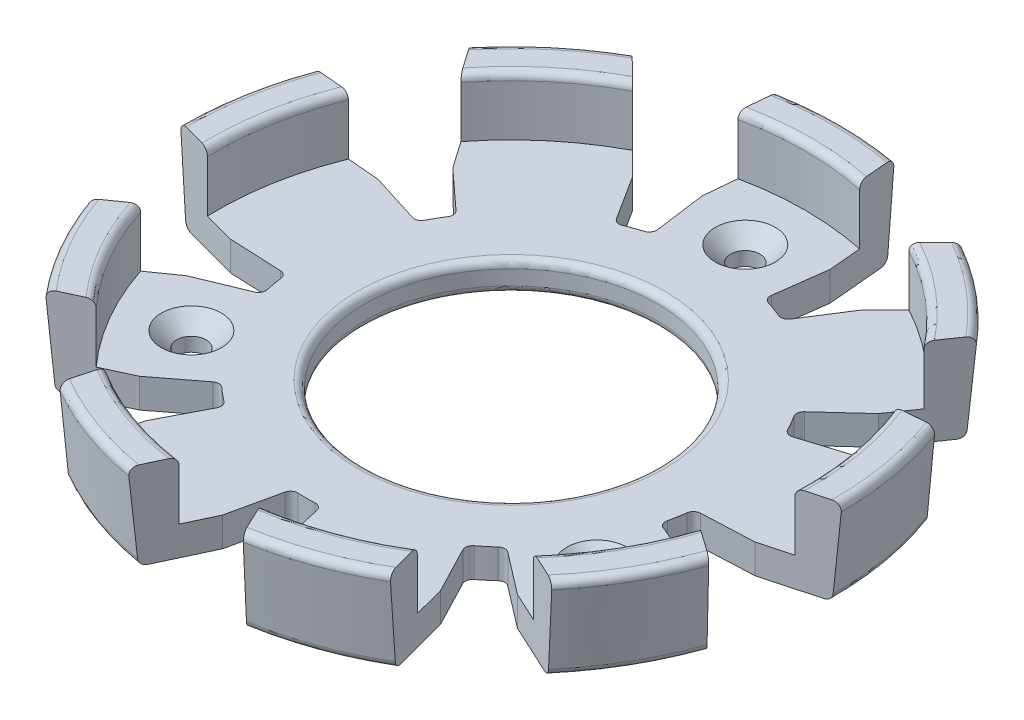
SolidWorks part; units mm, degrees
ref_plane "Plan de face" through (0, 0, 0) normal (0, 0, 1) x (1, 0, 0)
ref_plane "Plan de dessus" through (0, 0, 0) normal (0, 1, 0) x (1, 0, 0)
ref_plane "Plan de droite" through (0, 0, 0) normal (1, 0, 0) x (0, 0, -1)
ref_plane "Plan4" through (0, 2, 0) normal (0, 1, 0) x (-1, 0, 0)
sketch "Esquisse1" plane through (0, 2, 0) normal (0, 1, 0) x (-1, 0, 0)
  line L20 (-3.8364, -13.4641) -> (-4.3585, -17.4299)
  line L21 (-4.3585, -17.4299) -> (-3.9704, -21.7277)
  line L22 (3.9704, -21.7277) -> (4.3585, -17.4299)
  line L23 (4.3585, -17.4299) -> (3.8364, -13.4641)
  line L44 (0, 0) -> (-4.7883, -13.1557)
  line L45 (0, 0) -> (4.7883, -13.1557)
  arc A7 (-4.7883, -13.1557) -> (-3.8364, -13.4641) centre (0, 0) ccw
  arc A8 (-3.9704, -21.7277) -> (3.9704, -21.7277) centre (0, 0) ccw
  arc A9 (3.8364, -13.4641) -> (4.7883, -13.1557) centre (0, 0) ccw
  dimension "D1" = 22.0875
extrude "Extrusion1" add sketch "Esquisse1" against normal blind 2
sketch "Esquisse18" plane through (0, 2, 0) normal (0, 1, 0) x (1, 0, 0)
  line L0 (3.9704, 21.7277) -> (4.1578, 19.6525)
  line L1 (4.3585, 17.4299) -> (3.9704, 21.7277) construction
  line L2 (-3.9704, 21.7277) -> (-4.1578, 19.6525)
  line L3 (-3.9704, 21.7277) -> (-4.3585, 17.4299) construction
  arc A0 (3.9704, 21.7277) -> (-3.9704, 21.7277) centre (0, 0) ccw
  arc A1 (4.1578, 19.6525) -> (-4.1578, 19.6525) centre (0, 0) ccw
  dimension "D1" = 2
extrude "Extrusion13" add sketch "Esquisse18" along normal blind 4
draft "Dépouille1" type of draft neutral plane draft angle 5 faces to draft 1 parameters "D1"=5
fillet "Congé75" radius 0.5 5 edges at (3.8364, 1, -13.4641) (0, 0, -22.0875) (-3.8364, 1, -13.4641) (0, 6, -20.0875) (0, 6, -22.6124)
pattern_circular "Répétition circulaire1" count 9 over 360 about axis through (0, 0, 0) along (0, 1, 0) of "Extrusion1", "Extrusion13", "Dépouille1", "Congé75"
sketch "Esquisse11" plane through (0, 0, 0) normal (0, -1, 0) x (1, 0, 0)
  circle A0 centre (0, 0) radius 10
extrude "Extrusion11" cut sketch "Esquisse11" against normal up to next
hole_wizard "Perçage1" positions "Esquisse13" profile "Esquisse12" legacy
sketch "Esquisse13" plane through (0, 2, 0) normal (0, 1, 0) x (-1, 0, 0)
  point P0 (-13.8564, 8)
sketch "Esquisse12" plane through (13.8564, 2, 8) normal (1, 0, 0) x (0, 0, 1)
  line L0 (0, 0) -> (0, 2.001)
  line L1 (0, 2.001) -> (1, 2.001)
  line L2 (1, 2.001) -> (1, 1.054)
  line L3 (1, 1.054) -> (2.054, 0)
  line L4 (2.054, 0) -> (0, 0)
  line L5 (0, -6.4453) -> (0, 115.525) construction
  line L6 (-1, 1.054) -> (-2.054, 0) construction
  dimension "Diamètre" = 2
  dimension "Profondeur" = 2.001
  dimension "Angle fraisé" = 90
  dimension "Diamètre fraisé" = 4.108
fillet "Congé76" radius 0.5 2 edges at (0, 2, 10) (0, 0, 10)
pattern_circular "Répétition circulaire2" count 3 every 120 about axis through (0, 0, 0) along (0, 1, 0) of "Perçage1"
hole_wizard "Perçage2" positions "Esquisse15" profile "Esquisse14" legacy
sketch "Esquisse15" plane through (0, 2, 0) normal (0, 1, 0) x (-1, 0, 0)
  point P0 (13.8564, 8)
sketch "Esquisse14" plane through (-13.8564, 2, 8) normal (1, 0, 0) x (0, 0, 1)
  line L0 (0, 0) -> (0, 2.031)
  line L1 (0, 2.031) -> (1, 2.031)
  line L2 (1, 2.031) -> (1, 1.054)
  line L3 (1, 1.054) -> (2.054, 0)
  line L4 (2.054, 0) -> (0, 0)
  line L5 (0, -6.4453) -> (0, 115.525) construction
  line L6 (-1, 1.054) -> (-2.054, 0) construction
  dimension "Diamètre" = 2
  dimension "Profondeur" = 2.031
  dimension "Angle fraisé" = 90
  dimension "Diamètre fraisé" = 4.108
hole_wizard "Perçage3" positions "Esquisse17" profile "Esquisse16" legacy
sketch "Esquisse17" plane through (0, 2, 0) normal (0, 1, 0) x (-1, 0, 0)
  point P0 (0, -16)
sketch "Esquisse16" plane through (0, 2, -16) normal (1, 0, 0) x (0, 0, 1)
  line L0 (0, 0) -> (0, 2.031)
  line L1 (0, 2.031) -> (1, 2.031)
  line L2 (1, 2.031) -> (1, 1.054)
  line L3 (1, 1.054) -> (2.054, 0)
  line L4 (2.054, 0) -> (0, 0)
  line L5 (0, -6.4453) -> (0, 115.525) construction
  line L6 (-1, 1.054) -> (-2.054, 0) construction
  dimension "Diamètre" = 2
  dimension "Profondeur" = 2.031
  dimension "Angle fraisé" = 90
  dimension "Diamètre fraisé" = 4.108
